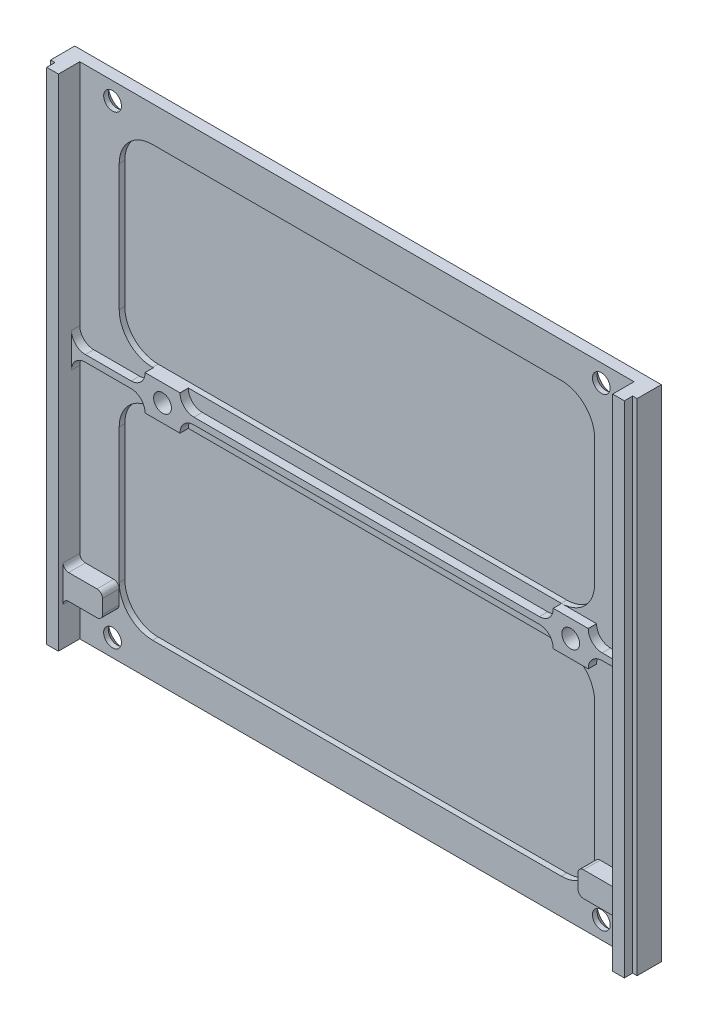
SolidWorks part; units mm, degrees
ref_plane "Front Plane" through (0, 0, 0) normal (0, 0, 1) x (1, 0, 0)
ref_plane "Top Plane" through (0, 0, 0) normal (0, 1, 0) x (1, 0, 0)
ref_plane "Right Plane" through (0, 0, 0) normal (1, 0, 0) x (0, 0, -1)
sketch "Sketch1" plane through (0, 0, 0) normal (0, 0, 1) x (1, 0, 0)
  line L1 (-52.8, -45) -> (52.8, -45)
  line L2 (-52.8, -45) -> (-52.8, 45)
  line L3 (-52.8, 45) -> (52.8, 45)
  line L4 (52.8, -45) -> (52.8, 45)
  line L5 (-52.8, -45) -> (52.8, 45) construction
  line L6 (-52.8, 45) -> (52.8, -45) construction
  point P0 (0, 0)
  dimension "D1" = 90
  dimension "D2" = 105.6
extrude "Plate" add sketch "Sketch1" along normal blind 5.85
sketch "Sketch2" plane through (0, 45, 0) normal (0, 1, 0) x (1, 0, 0)
  line L0 (52.8, -5.85) -> (-52.8, -5.85) construction
  line L1 (-49.9, -2) -> (49.9, -2)
  line L2 (-49.9, -2) -> (-49.9, -5.85)
  line L3 (-49.9, -5.85) -> (49.9, -5.85)
  line L4 (49.9, -2) -> (49.9, -5.85)
  line L5 (0, 0) -> (0, -5.85) construction
  line L6 (52.8, -5.85) -> (52.8, 0) construction
  line L7 (52.8, 0) -> (-52.8, 0) construction
  dimension "D1" = 2.9
  dimension "D2" = 2
extrude "Cut-Extrude1" cut sketch "Sketch2" against normal through all
sketch "Sketch3" plane through (0, 45, 0) normal (0, 1, 0) x (1, 0, 0)
  line L0 (0, 0) -> (0, -5.8) construction
  line L1 (52.8, -5.85) -> (52, -5.85)
  line L2 (52.8, -5.85) -> (52.8, -4.35)
  line L3 (52.8, -4.35) -> (52, -4.35)
  line L4 (52, -5.85) -> (52, -4.35)
  line L5 (-52.8, -5.85) -> (-52, -5.85)
  line L6 (-52.8, -5.85) -> (-52.8, -4.35)
  line L7 (-52.8, -4.35) -> (-52, -4.35)
  line L8 (-52, -5.85) -> (-52, -4.35)
  line L9 (52.8, 0) -> (-52.8, 0) construction
  dimension "D1" = 0.8
  dimension "D2" = 1.5
extrude "Cut-Extrude2" cut sketch "Sketch3" against normal through all
sketch "Sketch4" plane through (0, 0, 2) normal (0, 0, 1) x (1, 0, 0)
  line L0 (-52.8, 5) -> (52.8, 5) construction
  line L1 (-42.8, 37) -> (42.8, 37)
  line L2 (-42.8, 37) -> (-42.8, 8.15)
  line L3 (-42.8, 8.15) -> (42.8, 8.15)
  line L4 (42.8, 37) -> (42.8, 8.15)
  line L5 (-42.8, -37) -> (42.8, -37)
  line L6 (-42.8, -37) -> (-42.8, 1.85)
  line L7 (-42.8, 1.85) -> (42.8, 1.85)
  line L8 (42.8, -37) -> (42.8, 1.85)
  line L9 (-52.8, -45) -> (-52.8, 45) construction
  line L10 (52.8, -45) -> (52.8, 45) construction
  line L11 (49.9, -45) -> (-49.9, -45) construction
  line L12 (49.9, 45) -> (-49.9, 45) construction
  line L13 (0, 0) -> (0, -45) construction
  dimension "D1" = 50
  dimension "D2" = 10
  dimension "D3" = 8
  dimension "D4" = 8
  dimension "D5" = 6.3
extrude "Cut-Extrude3" [suppressed] cut sketch "Sketch4" against normal up to next
sketch "Sketch5" plane through (0, 0, 2) normal (0, 0, 1) x (1, 0, 0)
  line L1 (-36.65, -2.4) -> (-30.35, -2.4)
  line L2 (-36.65, -2.4) -> (-36.65, 0.15)
  line L3 (-36.65, 3.9) -> (-30.35, 3.9)
  line L4 (-30.35, -2.4) -> (-30.35, 0.15)
  line L5 (-36.65, -2.4) -> (-30.35, 3.9) construction
  line L6 (-36.65, 3.9) -> (-30.35, -2.4) construction
  line L8 (36.85, -2.4) -> (43.15, -2.4)
  line L9 (36.85, -2.4) -> (36.85, 0.15)
  line L10 (36.85, 3.9) -> (43.15, 3.9)
  line L11 (43.15, -2.4) -> (43.15, 0.15)
  line L12 (36.85, -2.4) -> (43.15, 3.9) construction
  line L13 (36.85, 3.9) -> (43.15, -2.4) construction
  line L14 (0, 0) -> (0, 45) construction
  line L15 (49.9, 45) -> (-49.9, 45) construction
  line L16 (52, -45) -> (52, 45) construction
  line L17 (-30.35, 1.35) -> (36.85, 1.35)
  line L18 (49.9, -45) -> (-49.9, -45) construction
  line L19 (-30.35, 0.15) -> (36.85, 0.15)
  line L20 (43.15, 1.35) -> (43.15, 3.9)
  line L21 (43.15, 1.35) -> (52, 1.35)
  line L22 (-36.65, 1.35) -> (-36.65, 3.9)
  line L23 (43.15, 0.15) -> (52, 0.15)
  line L24 (52, 1.35) -> (52, 0.15)
  line L25 (-52, -45) -> (-52, 45) construction
  line L26 (-36.65, 1.35) -> (-52, 1.35)
  line L27 (-30.35, 1.35) -> (-30.35, 3.9)
  line L28 (-36.65, 0.15) -> (-52, 0.15)
  line L29 (-52, 1.35) -> (-52, 0.15)
  line L30 (40, 0.75) -> (-33.5, 0.75) construction
  line L31 (36.85, 1.35) -> (36.85, 3.9)
  point P0 (-33.5, 0.75)
  point P7 (40, 0.75)
  dimension "D1" = 6.3
  dimension "D2" = 73.5
  dimension "D3" = 1.2
  dimension "D4" = 40
  dimension "D5" = 6.3
  dimension "D6" = 45.75
extrude "MUX Rib" add sketch "Sketch5" along normal offset from surface (1.5 mm away) 2.35
sketch "Sketch6" [suppressed] plane through (0, 0, 0) normal (0, 0, -1) x (-1, 0, 0)
  line L1 (-41.8, 35) -> (41.8, 35) construction
  line L2 (-43.3, -36.5) -> (43.3, -36.5)
  line L3 (-43.3, -36.5) -> (-43.3, 36.5)
  line L4 (-43.3, 36.5) -> (43.3, 36.5)
  line L5 (43.3, -36.5) -> (43.3, 36.5)
  line L6 (-43.3, -36.5) -> (43.3, 36.5) construction
  line L7 (-43.3, 36.5) -> (43.3, -36.5) construction
  line L8 (41.8, 35) -> (41.8, 10.15) construction
  line L9 (41.8, -35) -> (-41.8, -35) construction
  point P0 (0, 0)
  dimension "D1" = 1.5
  dimension "D2" = 1.5
  dimension "D3" = 1.5
extrude "Sheet Metal Slot" [suppressed] cut sketch "Sketch6" against normal blind 0.8
sketch "Sketch7" plane through (0, 0, 5.85) normal (0, 0, 1) x (1, 0, 0)
  line L0 (0, 0) -> (0, 45) construction
  line L1 (49.9, 45) -> (-49.9, 45) construction
  line L2 (-30.35, 3.9) -> (-36.65, 3.9) construction
  line L3 (-33.5, 0.75) -> (40, 0.75) construction
  line L4 (36.85, 1.35) -> (-30.35, 1.35) construction
  line L5 (-30.35, 0.15) -> (36.85, 0.15) construction
  line L6 (36.85, 3.9) -> (43.15, 3.9) construction
  circle A0 centre (40, 0.75) radius 1.6
  circle A1 centre (-33.5, 0.75) radius 1.6
  point P11 (-33.5, 3.9)
  point P18 (40, 3.9)
  dimension "D1" = 3.2
extrude "Cut-Extrude5" cut sketch "Sketch7" against normal through all
chamfer "Chamfer1" [suppressed] distance 1 angle 45
sketch "Sketch8" plane through (-52, 0, 0) normal (-1, 0, 0) x (0, 0, 1)
  line L0 (5.85, -45) -> (5.85, 45) construction
  line L1 (5.85, 40) -> (3.85, 40)
  line L2 (5.85, 40) -> (5.85, 25)
  line L3 (5.85, 25) -> (3.85, 25)
  line L4 (3.85, 40) -> (3.85, 25)
  line L5 (5.85, 45) -> (4.35, 45) construction
  dimension "D1" = 5
  dimension "D2" = 15
  dimension "D3" = 2
extrude "Cut-Extrude6" [suppressed] cut sketch "Sketch8" against normal through all
sketch "Sketch9" [suppressed] plane through (0, 0, 0.8) normal (0, 0, -1) x (-1, 0, 0)
  line L1 (-41.8, 35) -> (-35.5, 35)
  line L2 (-41.8, 35) -> (-41.8, 28.7)
  line L3 (-41.8, 28.7) -> (-35.5, 28.7)
  line L4 (-35.5, 35) -> (-35.5, 28.7)
  line L5 (41.8, 35) -> (35.5, 35)
  line L6 (41.8, 35) -> (41.8, 28.7)
  line L7 (41.8, 28.7) -> (35.5, 28.7)
  line L8 (35.5, 35) -> (35.5, 28.7)
  line L9 (-41.8, -35) -> (-35.5, -35)
  line L10 (-41.8, -35) -> (-41.8, -28.7)
  line L11 (-41.8, -28.7) -> (-35.5, -28.7)
  line L12 (-35.5, -35) -> (-35.5, -28.7)
  line L13 (41.8, -35) -> (35.5, -35)
  line L14 (41.8, -35) -> (41.8, -28.7)
  line L15 (41.8, -28.7) -> (35.5, -28.7)
  line L16 (35.5, -35) -> (35.5, -28.7)
  dimension "D1" = 6.3
extrude "Boss-Extrude3" [suppressed] add sketch "Sketch9" against normal up to surface (1.2 mm away)
sketch "Sketch10" [suppressed] plane through (0, 0, 0.8) normal (0, 0, -1) x (-1, 0, 0)
  line L1 (-39.4, -32.6) -> (39.4, -32.6) construction
  line L2 (-39.4, -32.6) -> (-39.4, 32.6) construction
  line L3 (-39.4, 32.6) -> (39.4, 32.6) construction
  line L4 (39.4, -32.6) -> (39.4, 32.6) construction
  line L5 (-39.4, -32.6) -> (39.4, 32.6) construction
  line L6 (-39.4, 32.6) -> (39.4, -32.6) construction
  line L8 (-35.5, 28.7) -> (-43.3, 36.5) construction
  circle A0 centre (39.4, 32.6) radius 1.6
  circle A1 centre (-39.4, 32.6) radius 1.6
  circle A2 centre (-39.4, -32.6) radius 1.6
  circle A3 centre (39.4, -32.6) radius 1.6
  point P2 (-39.4, 32.6)
  point P8 (0, 0)
  dimension "D1" = 3.2
extrude "Rivet Holes" [suppressed] cut sketch "Sketch10" against normal up to next
sketch "Sketch11" plane through (0, 0, 0) normal (0, 0, -1) x (-1, 0, 0)
  line L1 (-44, -41.85) -> (44, -41.85) construction
  line L2 (-44, -41.85) -> (-44, 41.85) construction
  line L3 (-44, 41.85) -> (44, 41.85) construction
  line L4 (44, -41.85) -> (44, 41.85) construction
  line L5 (-44, -41.85) -> (44, 41.85) construction
  line L6 (-44, 41.85) -> (44, -41.85) construction
  line L7 (-52.8, 45) -> (52.8, 45) construction
  line L10 (-52, -45) -> (-52, 45) construction
  circle A0 centre (44, 41.85) radius 1.6
  circle A1 centre (44, -41.85) radius 1.6
  circle A2 centre (-44, -41.85) radius 1.6
  circle A3 centre (-44, 41.85) radius 1.6
  point P0 (0, 0)
  dimension "D1" = 3.2
  dimension "D2" = 8
  dimension "D3" = 3.15
extrude "Screw to Top & Bottom" cut sketch "Sketch11" against normal through all
fillet "Fillet1" [suppressed] radius 3.5
fillet "Fillet2" [suppressed] radius 3
sketch "Sketch12" plane through (0, 0, 2) normal (0, 0, 1) x (1, 0, 0)
  line L0 (43.15, -2.4) -> (36.85, -2.4) construction
  line L1 (-42.8, 3.9) -> (42.8, 3.9)
  line L2 (-42.8, 3.9) -> (-42.8, 38.65)
  line L3 (-42.8, 38.65) -> (42.8, 38.65)
  line L4 (42.8, 3.9) -> (42.8, 38.65)
  line L5 (-42.8, 3.9) -> (42.8, 38.65) construction
  line L6 (-42.8, 38.65) -> (42.8, 3.9) construction
  line L7 (-42.8, -38.65) -> (42.8, -38.65)
  line L8 (-42.8, -38.65) -> (-42.8, -2.4)
  line L9 (-42.8, -2.4) -> (42.8, -2.4)
  line L10 (42.8, -38.65) -> (42.8, -2.4)
  line L11 (-42.8, -38.65) -> (42.8, -2.4) construction
  line L12 (-42.8, -2.4) -> (42.8, -38.65) construction
  line L13 (43.15, 3.9) -> (36.85, 3.9) construction
  line L15 (0, 21.275) -> (0, -20.525) construction
  line L21 (49.9, 45) -> (-49.9, 45) construction
  line L22 (52.8, -45) -> (52.8, 45) construction
  line L23 (49.9, -45) -> (-49.9, -45) construction
  point P0 (0, 21.275)
  point P5 (0, -20.525)
  dimension "D1" = 6.35
  dimension "D2" = 10
  dimension "D3" = 6.35
extrude "Cut-Extrude7" cut sketch "Sketch12" against normal offset from surface (1 mm away) 1
fillet "Fillet3" radius 6 8 edges at (42.8, 3.9, 1.5) (42.8, -2.4, 1.5) (-42.8, -2.4, 1.5) (-42.8, 3.9, 1.5) (-42.8, -38.65, 1.5) (42.8, -38.65, 1.5) (42.8, 38.65, 1.5) (-42.8, 38.65, 1.5)
fillet "Fillet6" radius 2.5 12 edges at (-49.9, 1.35, 2.75) (-30.35, 0.15, 2.75) (-36.65, 0.15, 2.75) (-36.65, 1.35, 2.75) (-30.35, 1.35, 2.75) (36.85, 1.35, 2.75) (36.85, 0.15, 2.75) (43.15, 1.35, 2.75) (43.15, 0.15, 2.75) (49.9, 0.15, 2.75) (-49.9, 0.15, 2.75) (49.9, 1.35, 2.75)
sketch "Sketch13" plane through (0, 0, 1) normal (0, 0, 1) x (1, 0, 0)
  line L0 (-36.8, 3.9) -> (36.8, 3.9) construction
  line L1 (42.8, 9.9) -> (42.8, 32.65) construction
  line L2 (36.8, 38.65) -> (-36.8, 38.65) construction
  line L3 (-42.8, 32.65) -> (-42.8, 9.9) construction
  line L4 (42.8, -32.65) -> (42.8, -8.4) construction
  line L5 (36.8, -2.4) -> (-36.8, -2.4) construction
  line L6 (-42.8, -8.4) -> (-42.8, -32.65) construction
  line L7 (-36.8, -38.65) -> (36.8, -38.65) construction
  line L8 (-36.8, 3.9) -> (36.8, 3.9)
  line L9 (42.8, 9.9) -> (42.8, 32.65)
  line L10 (36.8, 38.65) -> (-36.8, 38.65)
  line L11 (-42.8, 32.65) -> (-42.8, 9.9)
  line L12 (42.8, -32.65) -> (42.8, -8.4)
  line L13 (36.8, -2.4) -> (-36.8, -2.4)
  line L14 (-42.8, -8.4) -> (-42.8, -32.65)
  line L15 (-36.8, -38.65) -> (36.8, -38.65)
  arc A0 (36.8, 3.9) -> (42.8, 9.9) centre (36.8, 9.9) ccw construction
  arc A1 (42.8, 32.65) -> (36.8, 38.65) centre (36.8, 32.65) ccw construction
  arc A2 (-36.8, 38.65) -> (-42.8, 32.65) centre (-36.8, 32.65) ccw construction
  arc A3 (-42.8, 9.9) -> (-36.8, 3.9) centre (-36.8, 9.9) ccw construction
  arc A4 (42.8, -8.4) -> (36.8, -2.4) centre (36.8, -8.4) ccw construction
  arc A5 (-36.8, -2.4) -> (-42.8, -8.4) centre (-36.8, -8.4) ccw construction
  arc A6 (-42.8, -32.65) -> (-36.8, -38.65) centre (-36.8, -32.65) ccw construction
  arc A7 (36.8, -38.65) -> (42.8, -32.65) centre (36.8, -32.65) ccw construction
  arc A8 (36.8, 3.9) -> (42.8, 9.9) centre (36.8, 9.9) ccw
  arc A9 (42.8, 32.65) -> (36.8, 38.65) centre (36.8, 32.65) ccw
  arc A10 (-36.8, 38.65) -> (-42.8, 32.65) centre (-36.8, 32.65) ccw
  arc A11 (-42.8, 9.9) -> (-36.8, 3.9) centre (-36.8, 9.9) ccw
  arc A12 (42.8, -8.4) -> (36.8, -2.4) centre (36.8, -8.4) ccw
  arc A13 (-36.8, -2.4) -> (-42.8, -8.4) centre (-36.8, -8.4) ccw
  arc A14 (-42.8, -32.65) -> (-36.8, -38.65) centre (-36.8, -32.65) ccw
  arc A15 (36.8, -38.65) -> (42.8, -32.65) centre (36.8, -32.65) ccw
extrude "3D Print Removal" [suppressed] cut sketch "Sketch13" against normal through all
hole_wizard "CSK for M2.5 Flat Head Machine Screw1" positions "Sketch27" profile "Sketch26" countersink size "M2.5" standard "ANSI Metric"
sketch "Sketch27" plane through (0, 0, 0) normal (0, 0, -1) x (-1, 0, 0)
  point P0 (-44, 41.85)
  point P3 (-44, -41.85)
  point P6 (44, -41.85)
  point P9 (44, 41.85)
sketch "Sketch26" plane through (44, 41.85, 0) normal (1, 0, 0) x (0, 1, 0)
  line L0 (0, 0) -> (0, 5.85)
  line L1 (0, 5.85) -> (1.45, 5.85)
  line L2 (1.45, 5.85) -> (1.45, 1.3)
  line L3 (1.45, 1.3) -> (2.75, 0)
  line L5 (2.75, 0) -> (0, 0)
  line L6 (-1.45, 1.3) -> (-2.75, 0) construction
  line L11 (0, -6.35) -> (0, 107.95) construction
  dimension "Thru Hole Dia." = 2.9
  dimension "Thru Hole Depth" = 5.85
  dimension "Near C'Sink Dia." = 5.5
  dimension "Near C'Sink Angle" = 90
hole_wizard "CSK for M2.5 Flat Head Machine Screw2" positions "Sketch29" profile "Sketch28" countersink size "M2.5" standard "ANSI Metric"
sketch "Sketch29" plane through (0, 0, 0) normal (0, 0, -1) x (-1, 0, 0)
  point P0 (33.5, 0.75)
  point P3 (-40, 0.75)
sketch "Sketch28" plane through (-33.5, 0.75, 0) normal (1, 0, 0) x (0, 1, 0)
  line L0 (0, 0) -> (0, 5.85)
  line L1 (0, 5.85) -> (1.45, 5.85)
  line L2 (1.45, 5.85) -> (1.45, 1.3)
  line L3 (1.45, 1.3) -> (2.75, 0)
  line L5 (2.75, 0) -> (0, 0)
  line L6 (-1.45, 1.3) -> (-2.75, 0) construction
  line L11 (0, -6.35) -> (0, 107.95) construction
  dimension "Thru Hole Dia." = 2.9
  dimension "Thru Hole Depth" = 5.85
  dimension "Near C'Sink Dia." = 5.5
  dimension "Near C'Sink Angle" = 90
sketch "Sketch30" plane through (0, 0, 2) normal (0, 0, 1) x (1, 0, 0)
  line L0 (49.9, -45) -> (49.9, -2.35) construction
  line L1 (49.9, -37.15) -> (42.8, -37.15)
  line L2 (49.9, -37.15) -> (49.9, -32.65)
  line L3 (49.9, -32.65) -> (42.8, -32.65)
  line L4 (42.8, -37.15) -> (42.8, -32.65)
  line L5 (42.8, -32.65) -> (42.8, -8.4) construction
  line L6 (-49.9, -45) -> (-49.9, -2.35) construction
  line L7 (-49.9, -37.15) -> (-42.8, -37.15)
  line L8 (-49.9, -37.15) -> (-49.9, -32.65)
  line L9 (-49.9, -32.65) -> (-42.8, -32.65)
  line L10 (-42.8, -37.15) -> (-42.8, -32.65)
  arc A0 (36.8, -38.65) -> (42.8, -32.65) centre (36.8, -32.65) ccw construction
extrude "Boss-Extrude4" add sketch "Sketch30" along normal blind 3
fillet "Fillet7" radius 1 8 edges at (-42.8, -37.15, 3.5) (-42.8, -32.65, 3.5) (-49.9, -32.65, 3.5) (-49.9, -37.15, 3.5) (49.9, -32.65, 3.5) (42.8, -32.65, 3.5) (42.8, -37.15, 3.5) (49.9, -37.15, 3.5)
